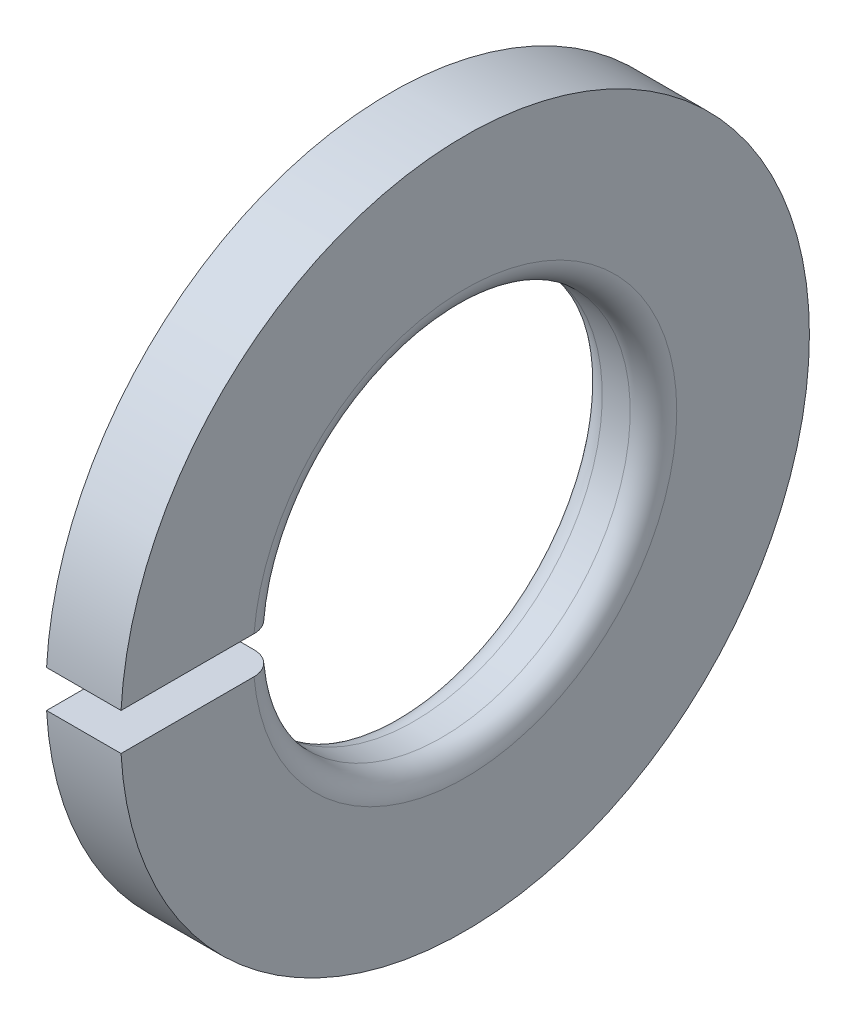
SolidWorks part; units mm, degrees
ref_plane "Plane1" through (0, 0, 0) normal (0, 0, 1) x (1, 0, 0)
ref_plane "Plane2" through (0, 0, 0) normal (0, 1, 0) x (1, 0, 0)
ref_plane "Plane3" through (0, 0, 0) normal (1, 0, 0) x (0, 0, -1)
revolve "Base-Revolve" add sketch "Sketch1" angle 360 about L0
sketch "Sketch1" plane through (0, 0, 0) normal (0, 0, 1) x (1, 0, 0)
  line L0 (-34.925, 0) -> (9.525, 0) construction
  line L1 (0, 4.55) -> (0, 7.4)
  line L2 (0, 7.4) -> (-1.6, 7.4)
  line L3 (-1.6, 7.4) -> (-1.6, 4.55)
  line L4 (-1.1, 4.05) -> (-0.5, 4.05)
  arc A0 (-1.1, 4.05) -> (-1.6, 4.55) centre (-1.1, 4.55) cw
  arc A1 (0, 4.55) -> (-0.5, 4.05) centre (-0.5, 4.55) cw
  point P8 (-1.6, 4.05)
  dimension "Fillet_rad" = 0.5
  dimension "D1" = 0.5
  dimension "Thickness" = 1.6
  dimension "Inside_dia" = 8.1
  dimension "Outside_dia" = 14.8
extrude "Gap" cut sketch "Sketch2" along normal through all
sketch "Sketch2" plane through (0, 0, 0) normal (-1, 0, 0) x (0, -1, 0)
  line L0 (-0.4, 0) -> (0.4, 0)
  line L1 (0, 0) -> (0, 12.7) construction
  line L2 (0.4, 0) -> (0.4, 7.548)
  line L3 (0.4, 7.548) -> (-0.4, 7.548)
  line L4 (-0.4, 7.548) -> (-0.4, 0)
  dimension "D1" = 0.8
  dimension "D2" = 7.548
equation "\"D1@Sketch1\" = \"Fillet_rad@Sketch1\""
equation "\"D1@Sketch2\" = \"Thickness@Sketch1\" * 0.5"
equation "\"D2@Sketch2\" = \"Outside_dia@Sketch1\" * 0.51"
